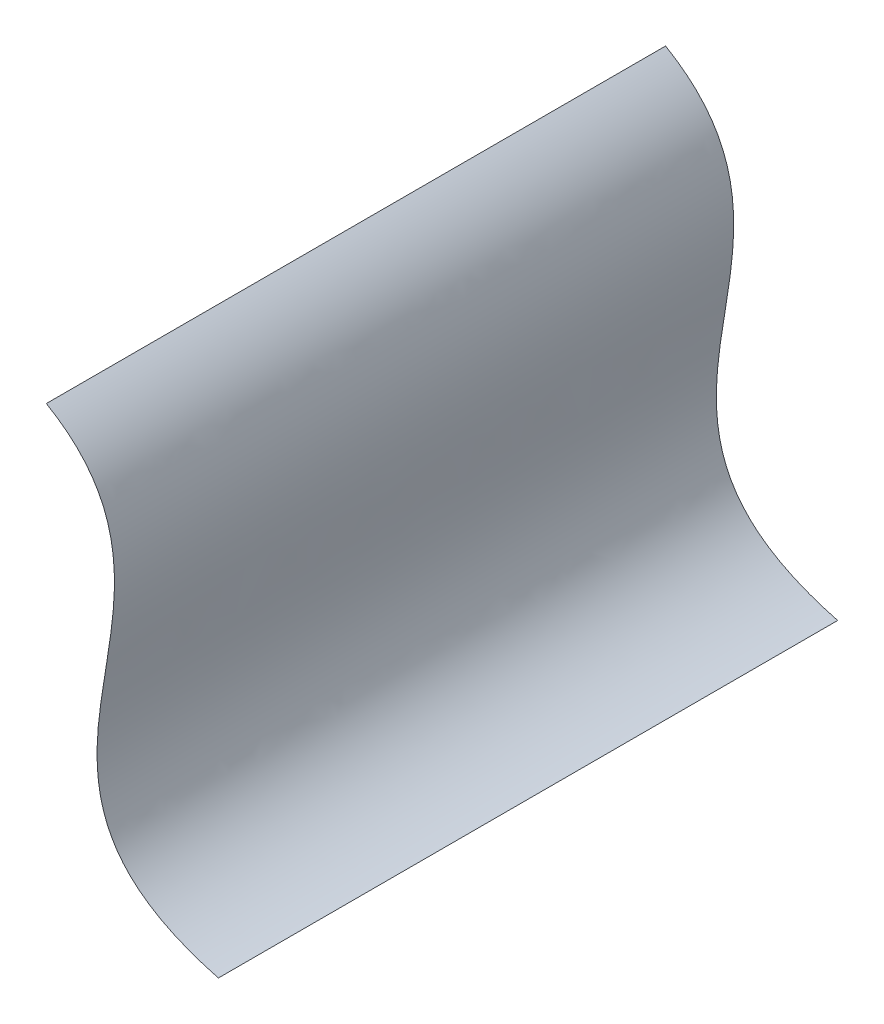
SolidWorks part; units mm, degrees
ref_plane "Front Plane" through (0, 0, 0) normal (0, 0, 1) x (1, 0, 0)
ref_plane "Top Plane" through (0, 0, 0) normal (0, 1, 0) x (1, 0, 0)
ref_plane "Right Plane" through (0, 0, 0) normal (1, 0, 0) x (0, 0, -1)
sketch "Sketch1" plane through (0, 0, 0) normal (0, 0, 1) x (1, 0, 0)
  spline S0 degree 3 poles (7.55, 66.4272) (59.8786, 36.0083) (-18.1472, -31.9244) (56.9592, -51.7078) knots 0 0 0 0 1 1 1 1
ref_plane "Plane1" through (91.44, 0, 0) normal (1, 0, 0) x (0, 0, -1)
sketch "Sketch2" plane through (91.44, 0, 0) normal (1, 0, 0) x (0, 0, -1)
  spline S0 degree 3 poles (80.6235, -33.2571) (124.8069, -18.1792) (52.6678, 33.551) (141.6033, 57.2974) (121.5658, 6.2132) (137.5175, -2.9518) knots 0 0 0 0 0.452356 0.676097 1 1 1 1
surface "Surface-Extrude1" sketch "Sketch1" parameters "D1"=177.8
